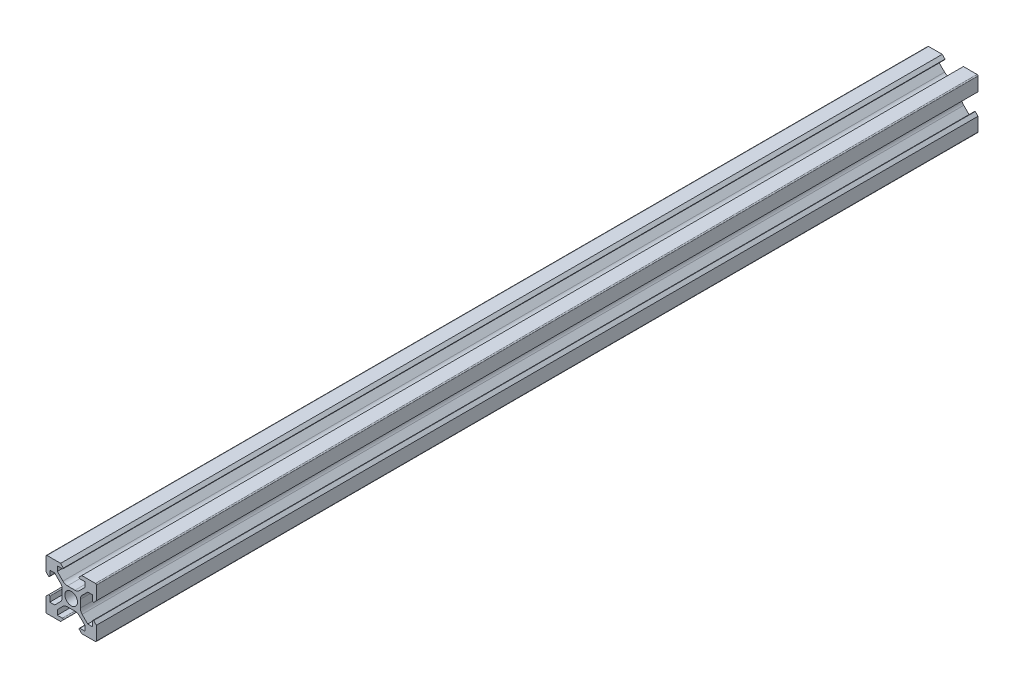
SolidWorks part; units mm, degrees
ref_plane "Plano frontal" through (0, 0, 0) normal (0, 0, 1) x (1, 0, 0)
ref_plane "Plano superior" through (0, 0, 0) normal (0, 1, 0) x (1, 0, 0)
ref_plane "Plano direito" through (0, 0, 0) normal (1, 0, 0) x (0, 0, -1)
sketch "Esboço1" plane through (0, 0, 0) normal (0, 0, 1) x (1, 0, 0)
  line L0 (-3.1, 8.9) -> (-4.2, 10)
  line L1 (-9.6, 10) -> (-4.2, 10)
  line L2 (-3.6, 1.5038) -> (-3.6, 0)
  line L3 (-8.5, 5.5) -> (-8.5, 3.5)
  line L4 (-6.5607, 5.5) -> (-4.3322, 3.2716)
  line L5 (-8.5, 5.5) -> (-6.5607, 5.5)
  line L6 (-10, 9.6) -> (-10, 4.2)
  line L7 (-8.9, 3.1) -> (-10, 4.2)
  line L8 (0, 3.6) -> (0, -3.6) construction
  line L9 (9.8828, -9.8828) -> (0, 0) construction
  line L10 (9.8828, 9.8828) -> (0, 0) construction
  line L11 (3.6, -1.5038) -> (3.6, 0)
  line L12 (8.5, -5.5) -> (8.5, -3.5)
  line L13 (-5.5, 8.5) -> (-5.5, 6.5607)
  line L14 (6.5607, -5.5) -> (4.3322, -3.2716)
  line L15 (8.5, -5.5) -> (6.5607, -5.5)
  line L16 (3.1, -8.9) -> (4.2, -10)
  line L17 (9.6, -10) -> (4.2, -10)
  line L18 (5.5, -8.5) -> (5.5, -6.5607)
  line L19 (-18.5, 8.5) -> (-18.5, -8.5) construction
  line L20 (5.5, -6.5607) -> (3.2716, -4.3322)
  line L21 (5.5, -8.5) -> (3.5, -8.5)
  line L22 (10, -9.6) -> (10, -4.2)
  line L23 (-9.8828, 9.8828) -> (0, 0) construction
  line L24 (8.9, -3.1) -> (10, -4.2)
  line L25 (-5.5, 6.5607) -> (-3.2716, 4.3322)
  line L26 (5.5, 8.5) -> (3.5, 8.5)
  line L27 (-20, 10) -> (-20, -10) construction
  line L28 (5.5, 6.5607) -> (3.2716, 4.3322)
  line L29 (5.5, 8.5) -> (5.5, 6.5607)
  line L30 (8.9, 3.1) -> (10, 4.2)
  line L31 (10, 9.6) -> (10, 4.2)
  line L32 (8.5, 5.5) -> (6.5607, 5.5)
  line L33 (-5.5, 8.5) -> (-3.5, 8.5)
  line L34 (6.5607, 5.5) -> (4.3322, 3.2716)
  line L35 (8.5, 5.5) -> (8.5, 3.5)
  line L36 (-20, 10) -> (0, 10) construction
  line L37 (3.6, 1.5038) -> (3.6, 0)
  line L38 (9.6, 10) -> (4.2, 10)
  line L39 (-18.5, 8.5) -> (-1.5, 8.5) construction
  line L40 (-1.5038, 3.6) -> (1.5038, 3.6)
  line L41 (3.1, 8.9) -> (4.2, 10)
  line L42 (-8.9, -3.1) -> (-10, -4.2)
  line L43 (-10, -9.6) -> (-10, -4.2)
  line L44 (-1.5038, -3.6) -> (1.5038, -3.6)
  line L45 (-5.5, -8.5) -> (-3.5, -8.5)
  line L46 (-5.5, -6.5607) -> (-3.2716, -4.3322)
  line L47 (-5.5, -8.5) -> (-5.5, -6.5607)
  line L48 (-9.6, -10) -> (-4.2, -10)
  line L49 (-3.1, -8.9) -> (-4.2, -10)
  line L50 (-8.5, -5.5) -> (-6.5607, -5.5)
  line L51 (-6.5607, -5.5) -> (-4.3322, -3.2716)
  line L52 (-8.5, -5.5) -> (-8.5, -3.5)
  line L53 (-3.6, -1.5038) -> (-3.6, 0)
  line L54 (0, 10) -> (0, -10) construction
  line L55 (-20, -10) -> (0, -10) construction
  line L56 (-9.8828, -9.8828) -> (0, 0) construction
  line L57 (-18.5, -8.5) -> (-1.5, -8.5) construction
  line L58 (-1.5, 8.5) -> (-1.5, -8.5) construction
  arc A0 (2.5, 0) -> (-2.5, 0) centre (0, 0) ccw
  arc A1 (-3.5, 8.5) -> (-3.1, 8.9) centre (-3.5, 8.9) ccw
  arc A2 (-9.6, 10) -> (-10, 9.6) centre (-9.6, 9.6) ccw
  arc A3 (-3.2716, 4.3322) -> (-1.5038, 3.6) centre (-1.5038, 6.1) ccw
  arc A4 (-4.3322, 3.2716) -> (-3.6, 1.5038) centre (-6.1, 1.5038) cw
  arc A5 (-8.5, 3.5) -> (-8.9, 3.1) centre (-8.9, 3.5) cw
  arc A6 (3.5, -8.5) -> (3.1, -8.9) centre (3.5, -8.9) ccw
  arc A7 (3.2716, -4.3322) -> (1.5038, -3.6) centre (1.5038, -6.1) ccw
  arc A8 (4.3322, -3.2716) -> (3.6, -1.5038) centre (6.1, -1.5038) cw
  arc A9 (10, -9.6) -> (9.6, -10) centre (9.6, -9.6) cw
  arc A10 (8.5, -3.5) -> (8.9, -3.1) centre (8.9, -3.5) cw
  arc A11 (8.5, 3.5) -> (8.9, 3.1) centre (8.9, 3.5) ccw
  arc A12 (4.3322, 3.2716) -> (3.6, 1.5038) centre (6.1, 1.5038) ccw
  arc A13 (3.2716, 4.3322) -> (1.5038, 3.6) centre (1.5038, 6.1) cw
  arc A14 (9.6, 10) -> (10, 9.6) centre (9.6, 9.6) cw
  arc A15 (3.5, 8.5) -> (3.1, 8.9) centre (3.5, 8.9) cw
  arc A16 (-2.5, 0) -> (2.5, 0) centre (0, 0) ccw
  arc A17 (-8.5, -3.5) -> (-8.9, -3.1) centre (-8.9, -3.5) ccw
  arc A18 (-10, -9.6) -> (-9.6, -10) centre (-9.6, -9.6) ccw
  arc A19 (-4.3322, -3.2716) -> (-3.6, -1.5038) centre (-6.1, -1.5038) ccw
  arc A20 (-3.2716, -4.3322) -> (-1.5038, -3.6) centre (-1.5038, -6.1) cw
  arc A21 (-3.5, -8.5) -> (-3.1, -8.9) centre (-3.5, -8.9) cw
  point P103 (0, 0)
  dimension "D1" = 45
  dimension "D3" = 20
  dimension "D2" = 0.4
extrude "Ressalto-extrusão1" add sketch "Esboço1" along normal mid plane 350
